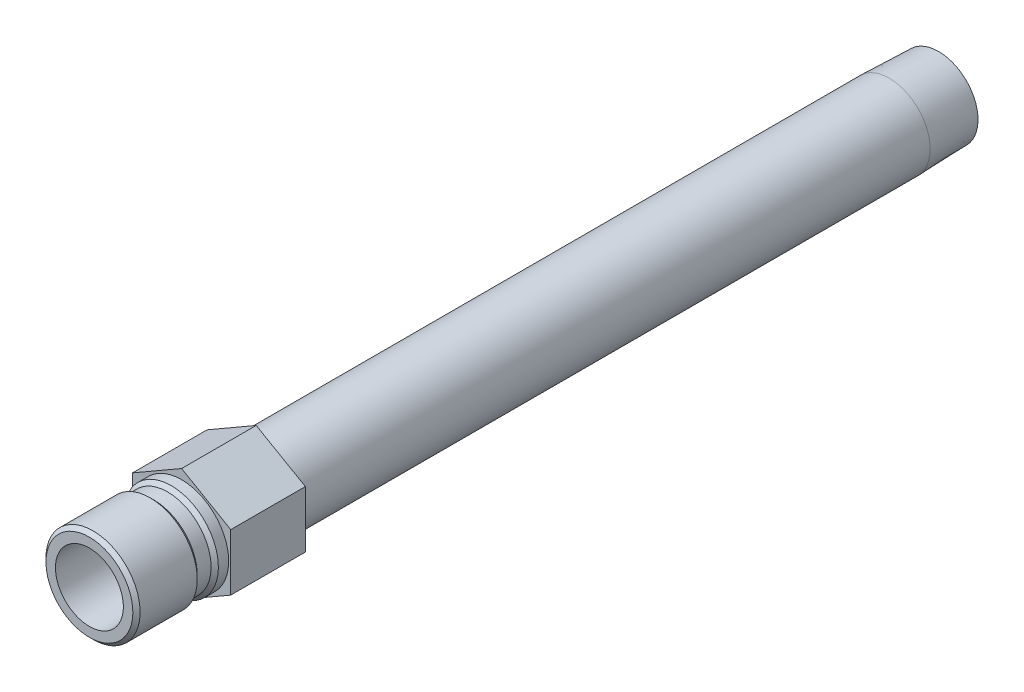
SolidWorks part; units mm, degrees
ref_plane "Front Plane" through (0, 0, 0) normal (0, 0, 1) x (1, 0, 0)
ref_plane "Top Plane" through (0, 0, 0) normal (0, 1, 0) x (1, 0, 0)
ref_plane "Right Plane" through (0, 0, 0) normal (1, 0, 0) x (0, 0, -1)
sketch "Sketch1" plane through (0, 0, 0) normal (1, 0, 0) x (0, 0, -1)
  line L0 (0, 0) -> (-22.479, 0) construction
  line L1 (-19.304, 7.112) -> (-19.304, 9.0932)
  line L2 (-5.8166, 9.0932) -> (-5.8166, 0) construction
  line L3 (-18.542, 9.8552) -> (-6.5786, 9.8552)
  line L4 (0, 8.5725) -> (0, 0) construction
  line L5 (-5.8166, 9.0932) -> (-2.921, 9.0932)
  line L6 (-2.159, 9.8552) -> (0, 9.8552)
  line L7 (0, 9.8552) -> (0, 8.5725)
  line L8 (-5.8166, 9.0932) -> (-6.5786, 9.8552)
  line L9 (-2.921, 9.0932) -> (-2.159, 9.8552)
  line L10 (-19.304, 9.0932) -> (-18.542, 9.8552)
  line L11 (-19.304, 7.112) -> (-1.524, 7.112)
  line L12 (0, 8.5725) -> (148.1582, 8.5725)
  line L13 (148.1582, 8.5725) -> (158.496, 8.2494)
  line L14 (158.496, 8.2494) -> (158.496, 6.2611)
  line L15 (0, 9.8552) -> (15.621, 9.8552) construction
  line L16 (15.621, 9.8552) -> (15.621, 0) construction
  line L17 (15.621, 0) -> (0, 0) construction
  line L18 (-1.0716, 6.2611) -> (-1.524, 7.112)
  line L19 (-1.0716, 6.2611) -> (158.496, 6.2611)
  dimension "D1" = 19.304
  dimension "D2" = 2.8956
  dimension "D3" = 0.762
  dimension "D4" = 45
  dimension "D5" = 13.4874
  dimension "D6" = 45
  dimension "D7" = 1.79
  dimension "D8" = 10.3378
  dimension "D9" = 177.8
  dimension "D10" = 3.175
  dimension "D11" = 34.925
  dimension "D12" = 14.224
  dimension "D13" = 17.145
  dimension "D14" = 19.7104
  dimension "D15" = 12.5222
  dimension "D16" = 118
  dimension "D17" = 17.78
revolve "Revolve1" add sketch "Sketch1" angle 360 about L0
sketch "Sketch2" plane through (0, 0, 0) normal (0, 0, 1) x (1, 0, 0)
  line L1 (-10.287, 5.9392) -> (-10.287, -5.9392)
  line L2 (-10.287, -5.9392) -> (0, -11.8784)
  line L3 (0, -11.8784) -> (10.287, -5.9392)
  line L4 (10.287, -5.9392) -> (10.287, 5.9392)
  line L5 (10.287, 5.9392) -> (0, 11.8784)
  line L6 (0, 11.8784) -> (-10.287, 5.9392)
  circle A0 centre (0, 0) radius 10.287 construction
  circle A1 centre (0, 0) radius 7.112 construction
  circle A2 centre (0, 0) radius 7.112
  dimension "D1" = 20.574
extrude "Boss-Extrude1" add sketch "Sketch2" against normal up to vertex (15.621 mm away) from vertex at 0
